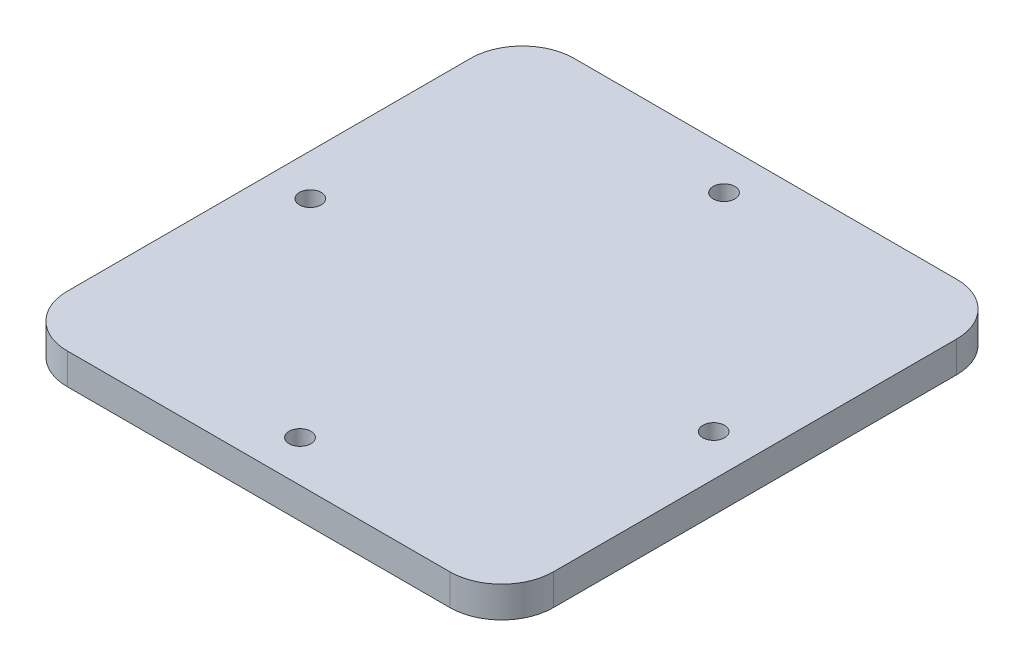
SolidWorks part; units mm, degrees
ref_plane "Front Plane" through (0, 0, 0) normal (0, 0, 1) x (1, 0, 0)
ref_plane "Top Plane" through (0, 0, 0) normal (0, 1, 0) x (1, 0, 0)
ref_plane "Right Plane" through (0, 0, 0) normal (1, 0, 0) x (0, 0, -1)
sketch "Sketch1" plane through (0, 0, 0) normal (0, 1, 0) x (1, 0, 0)
  line L1 (10, 0) -> (84, 0)
  line L2 (0, 10) -> (0, 88)
  line L3 (10, 98) -> (84, 98)
  line L4 (94, 10) -> (94, 88)
  arc A0 (0, 88) -> (10, 98) centre (10, 88) cw
  arc A1 (10, 0) -> (0, 10) centre (10, 10) cw
  arc A2 (94, 10) -> (84, 0) centre (84, 10) cw
  arc A3 (94, 88) -> (84, 98) centre (84, 88) ccw
  point P7 (0, 98)
  point P10 (0, 0)
  point P13 (94, 0)
  dimension "D3" = 10
  dimension "D1" = 98
  dimension "D2" = 94
extrude "Extrude1" add sketch "Sketch1" along normal blind 6
hole_wizard "M5 Tapped Hole2" positions "3DSketch3" profile "Sketch6" tap size "M5" standard "ISO"
sketch3d "3DSketch3"
  line L0 (84, 6, -98) -> (10, 6, -98) construction
  line L1 (0, 6, -88) -> (0, 6, -10) construction
  line L2 (10, 6, 0) -> (84, 6, 0) construction
  line L3 (94, 6, -10) -> (94, 6, -88) construction
  point P1 (47, 6, -90)
  point P3 (8, 6, -49)
  point P5 (47, 6, -8)
  point P7 (86, 6, -49)
  dimension "D1" = 8
  dimension "D2" = 8
  dimension "D3" = 8
  dimension "D4" = 8
  dimension "D5" = 47
  dimension "D6" = 47
  dimension "D7" = 49
  dimension "D8" = 49
sketch "Sketch6" plane through (47, 6, -90) normal (1, 0, 0) x (0, 0, 1)
  line L0 (0, 0) -> (0, 6)
  line L1 (0, 6) -> (2.1, 6)
  line L2 (2.1, 6) -> (2.1, 0)
  line L5 (2.1, 0) -> (0, 0)
  line L11 (0, -6.35) -> (0, 107.95) construction
  dimension "Thru Tap Drill Dia." = 4.2
  dimension "Thru Tap Drill Depth" = 6
